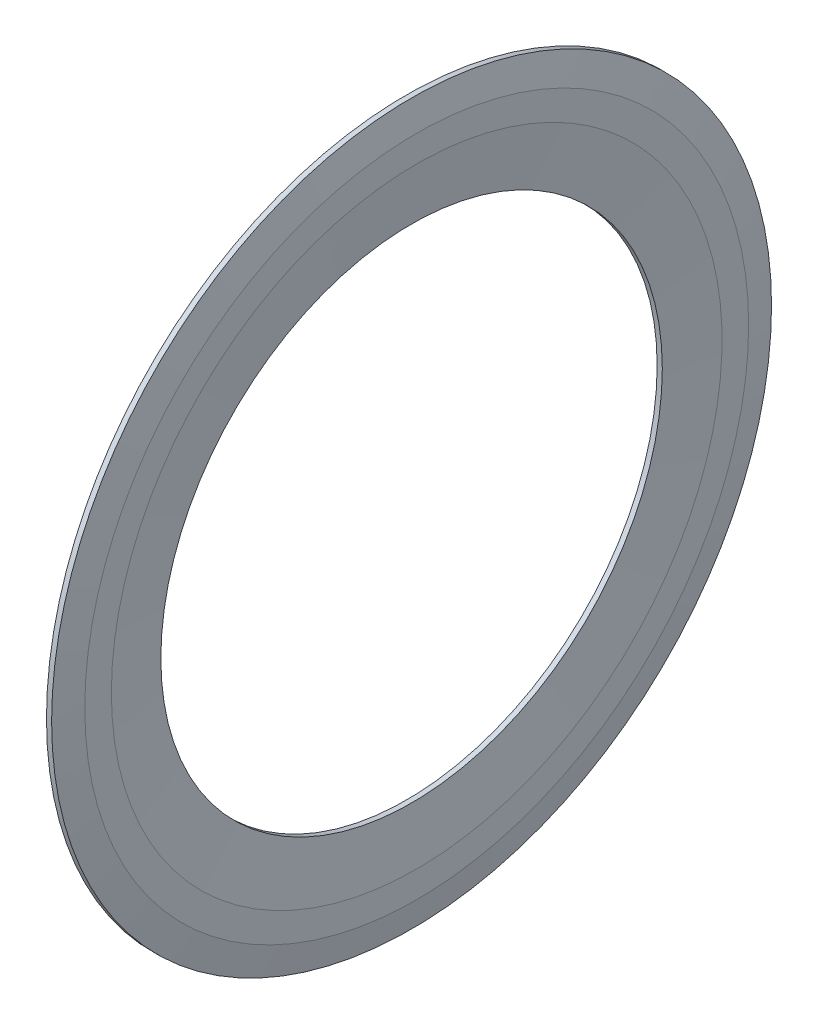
SolidWorks part; units mm, degrees
ref_plane "Front Plane" through (0, 0, 0) normal (0, 0, 1) x (1, 0, 0)
ref_plane "Top Plane" through (0, 0, 0) normal (0, 1, 0) x (1, 0, 0)
ref_plane "Right Plane" through (0, 0, 0) normal (1, 0, 0) x (0, 0, -1)
ref_plane "Plane4" through (0, 0, 0) normal (0, 0, 1) x (1, 0, 0)
sketch "Sketch1" plane through (0, 0, 0) normal (0, 0, 1) x (1, 0, 0)
  line L0 (0.31, 5.05) -> (0.4135, 5.05)
  line L1 (0.4135, 5.05) -> (0.517, 6.15)
  line L2 (0.517, 6.15) -> (0.517, 6.6854)
  line L3 (0.517, 6.6854) -> (0.4135, 7.25)
  line L4 (0.4135, 7.25) -> (0.31, 7.25)
  line L5 (0.31, 7.25) -> (0.3617, 6.7)
  line L6 (0.3617, 6.7) -> (0.31, 6.15)
  line L7 (0.31, 6.15) -> (0.31, 5.05)
  line L8 (0.4135, 0) -> (0.31, 0) construction
revolve "Revolve1" add sketch "Sketch1" angle 360 about L8
